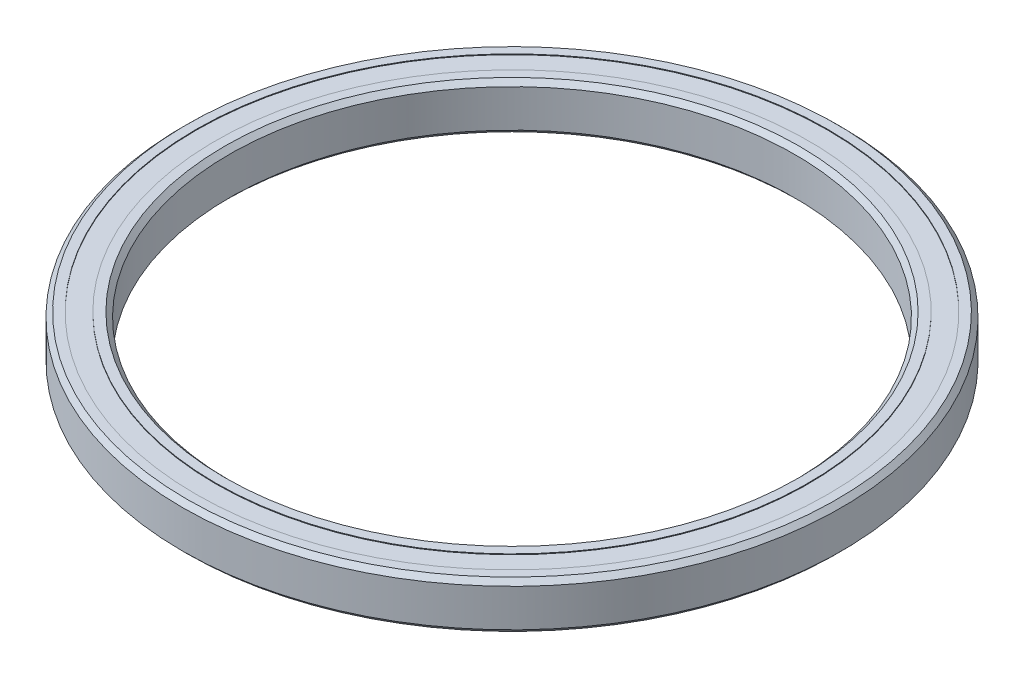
SolidWorks part; units mm, degrees
ref_plane "Front" through (0, 0, 0) normal (0, 0, 1) x (1, 0, 0)
ref_plane "Top" through (0, 0, 0) normal (0, 1, 0) x (1, 0, 0)
ref_plane "Right" through (0, 0, 0) normal (1, 0, 0) x (0, 0, -1)
sketch "Sketch1" plane through (0, 0, 0) normal (0, 1, 0) x (1, 0, 0)
  circle A0 centre (0, 0) radius 38.1
  circle A1 centre (0, 0) radius 44.45
  dimension "D1" = 76.2
  dimension "D2" = 88.9
extrude "Extrude1" add sketch "Sketch1" along normal mid plane 6.35
sketch "Sketch2" plane through (0, 3.175, 0) normal (0, 1, 0) x (-1, 0, 0)
  circle A0 centre (0, 0) radius 39.9796
  circle A1 centre (0, 0) radius 42.6212
  dimension "D1" = 79.9592
  dimension "D2" = 85.2424
extrude "Cut-Extrude1" cut sketch "Sketch2" against normal blind 0.1
mirror "Mirror1" about plane through (0, 0, 0) normal (0, 1, 0) of "Cut-Extrude1"
chamfer "Chamfer1" distance 0.635 angle 45 4 edges at (0, 3.175, 38.1) (0, 3.175, 44.45) (0, -3.175, 38.1) (0, -3.175, 44.45)
